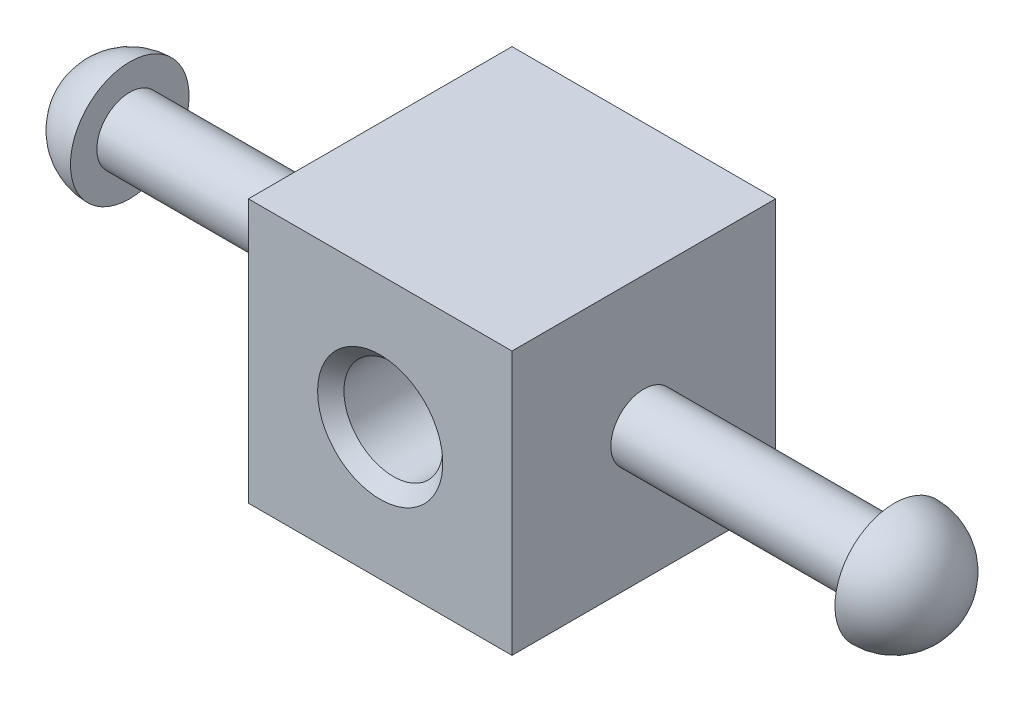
SolidWorks part; units mm, degrees
ref_plane "Front Plane" through (0, 0, 0) normal (0, 0, 1) x (1, 0, 0)
ref_plane "Top Plane" through (0, 0, 0) normal (0, 1, 0) x (1, 0, 0)
ref_plane "Right Plane" through (0, 0, 0) normal (1, 0, 0) x (0, 0, -1)
sketch "Sketch1" plane through (0, 0, 0) normal (0, 0, 1) x (1, 0, 0)
  line L1 (0, 0) -> (25.4, 0)
  line L2 (0, 0) -> (0, 25.4)
  line L3 (0, 25.4) -> (25.4, 25.4)
  line L4 (25.4, 0) -> (25.4, 25.4)
  circle A0 centre (12.7, 12.7) radius 4.7625
  dimension "D5" = 9.525
  dimension "D1" = 25.4
  dimension "D2" = 25.4
  dimension "D3" = 12.7
  dimension "D4" = 12.7
extrude "Boss-Extrude1" add sketch "Sketch1" along normal blind 25.4
sketch "Sketch2" plane through (25.4, 0, 0) normal (1, 0, 0) x (0, 0, -1)
  line L0 (-25.4, 25.4) -> (0, 25.4) construction
  line L2 (0, 0) -> (0, 25.4) construction
  circle A0 centre (-12.7, 12.7) radius 3.175
  dimension "D3" = 6.35
  dimension "D1" = 12.7
  dimension "D2" = 12.7
extrude "Boss-Extrude2" add sketch "Sketch2" along normal blind 24.13
sketch "Sketch4" plane through (49.53, 0, 0) normal (1, 0, 0) x (0, 0, -1)
  line L0 (-12.7, 15.875) -> (-12.7, 12.7)
  circle A0 centre (-12.7, 12.7) radius 3.175 construction
  circle A1 centre (-12.7, 12.7) radius 3.175 construction
ref_plane "Plane1" through (0, 0, 12.7) normal (0, 0, -1) x (0, -1, 0)
sketch "Sketch5" plane through (0, 0, 12.7) normal (0, 0, -1) x (0, -1, 0)
  line L0 (-12.7, -49.53) -> (-18.415, -49.53)
  line L1 (-15.875, -49.53) -> (-12.7, -49.53) construction
  line L2 (-15.875, -25.4) -> (-15.875, -49.53) construction
  line L3 (-12.7, -55.245) -> (-12.7, -49.53)
  arc A0 (-18.415, -49.53) -> (-12.7, -55.245) centre (-12.7, -49.53) ccw
  dimension "D1" = 5.715
  dimension "D2" = 3.175
revolve "Revolve1" add sketch "Sketch5" angle 360 about L3
sketch "Sketch6" plane through (0, 0, 12.7) normal (0, 0, -1) x (0, -1, 0)
  line L0 (-12.7, 0) -> (-12.7, 24.13)
  line L1 (-25.4, 0) -> (0, 0) construction
  line L3 (-15.875, 24.13) -> (-15.875, 0)
  line L4 (-15.875, 0) -> (-12.7, 0)
  line L5 (-15.875, 24.13) -> (-18.415, 24.13)
  line L6 (-12.7, 24.13) -> (-12.7, 29.845)
  arc A0 (-18.415, 24.13) -> (-12.7, 29.845) centre (-12.7, 24.13) cw
  dimension "D1" = 5.715
  dimension "D2" = 3.175
  dimension "D3" = 24.13
  dimension "D4" = 29.845
revolve "Revolve2" add sketch "Sketch6" angle 360 about L0
chamfer "Chamfer1" distance 1.27 angle 45 2 edges at (17.4625, 12.7, 0) (17.4625, 12.7, 25.4)
